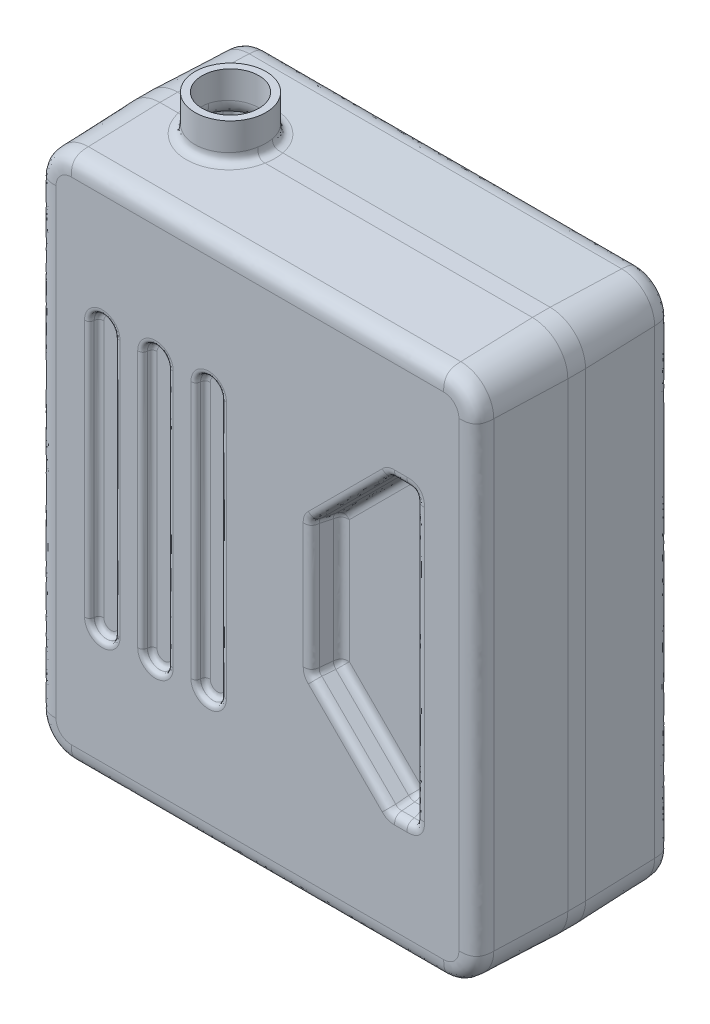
SolidWorks part; units mm, degrees
ref_plane "Front Plane" through (0, 0, 0) normal (0, 0, 1) x (1, 0, 0)
ref_plane "Top Plane" through (0, 0, 0) normal (0, 1, 0) x (1, 0, 0)
ref_plane "Right Plane" through (0, 0, 0) normal (1, 0, 0) x (0, 0, -1)
sketch "Sketch1" plane through (0, 0, 0) normal (0, 0, 1) x (1, 0, 0)
  line L1 (0, 0) -> (250, 0)
  line L2 (0, 0) -> (0, 300)
  line L3 (0, 300) -> (250, 300)
  line L4 (250, 0) -> (250, 300)
  dimension "D1" = 250
  dimension "D2" = 300
sketch "Sketch2" plane through (0, 0, 0) normal (0, 0, 1) x (1, 0, 0)
  line L0 (0, 280) -> (0, 20)
  line L1 (20, 0) -> (230, 0)
  line L2 (250, 20) -> (250, 280)
  line L3 (230, 300) -> (70, 300)
  line L4 (35, 300) -> (35, 320)
  line L5 (35, 320) -> (70, 320)
  line L6 (70, 320) -> (70, 300)
  line L8 (215, 67.5) -> (200, 67.5)
  line L9 (200, 67.5) -> (155, 112.5)
  line L10 (155, 112.5) -> (155, 187.5)
  line L11 (155, 187.5) -> (200, 232.5)
  line L12 (200, 232.5) -> (215, 232.5)
  line L13 (215, 150) -> (155, 150) construction
  line L14 (215, 232.5) -> (215, 67.5)
  line L15 (35, 300) -> (20, 300)
  arc A0 (0, 20) -> (20, 0) centre (20, 20) ccw
  arc A1 (230, 0) -> (250, 20) centre (230, 20) ccw
  arc A2 (250, 280) -> (230, 300) centre (230, 280) ccw
  arc A3 (0, 280) -> (20, 300) centre (20, 280) cw
  point P10 (0, 0)
  point P13 (250, 0)
  point P16 (250, 300)
  point P19 (0, 300)
  point P34 (250, 150)
  dimension "D1" = 20
  dimension "D2" = 35
  dimension "D3" = 165
  dimension "D4" = 15
  dimension "D5" = 60
  dimension "D6" = 35
  dimension "D7" = 20
  dimension "D8" = 15
sketch "Sketch3" plane through (0, 0, 0) normal (0, 0, 1) x (1, 0, 0)
  line L0 (230, 300) -> (70, 300) construction
  line L4 (35, 300) -> (20, 300) construction
  line L5 (0, 280) -> (0, 20) construction
  line L6 (20, 0) -> (230, 0) construction
  line L7 (250, 20) -> (250, 280) construction
  line L8 (230, 300) -> (70, 300)
  line L12 (70, 300) -> (20, 300)
  line L13 (0, 280) -> (0, 20)
  line L14 (20, 0) -> (230, 0)
  line L15 (250, 20) -> (250, 280)
  arc A0 (20, 300) -> (0, 280) centre (20, 280) ccw construction
  arc A1 (0, 20) -> (20, 0) centre (20, 20) ccw construction
  arc A2 (230, 0) -> (250, 20) centre (230, 20) ccw construction
  arc A3 (250, 280) -> (230, 300) centre (230, 280) ccw construction
  arc A4 (20, 300) -> (0, 280) centre (20, 280) ccw
  arc A5 (0, 20) -> (20, 0) centre (20, 20) ccw
  arc A6 (230, 0) -> (250, 20) centre (230, 20) ccw
  arc A7 (250, 280) -> (230, 300) centre (230, 280) ccw
extrude "Boss-Extrude1" add sketch "Sketch3" along normal blind 50 draft 2
sketch "Sketch4" plane through (0, 0, 50) normal (0, 0, 1) x (1, 0, 0)
  line L0 (215, 232.5) -> (215, 67.5) construction
  line L1 (215, 67.5) -> (200, 67.5) construction
  line L2 (200, 67.5) -> (155, 112.5) construction
  line L3 (155, 112.5) -> (155, 187.5) construction
  line L4 (155, 187.5) -> (200, 232.5) construction
  line L5 (200, 232.5) -> (215, 232.5) construction
  line L6 (215, 232.5) -> (215, 67.5)
  line L7 (215, 67.5) -> (200, 67.5)
  line L8 (200, 67.5) -> (155, 112.5)
  line L9 (155, 112.5) -> (155, 187.5)
  line L10 (155, 187.5) -> (200, 232.5)
  line L11 (200, 232.5) -> (215, 232.5)
extrude "Cut-Extrude1" cut sketch "Sketch4" against normal blind 15 draft 10
sketch "Sketch5" plane through (0, 0, 50) normal (0, 0, 1) x (1, 0, 0)
  line L0 (37.5, 222.5) -> (37.5, 77.5) construction
  line L1 (45, 222.5) -> (45, 77.5)
  line L2 (30, 222.5) -> (30, 77.5)
  line L4 (37.5, 150) -> (142.9758, 150) construction
  line L5 (67.5, 222.5) -> (67.5, 77.5) construction
  line L6 (75, 222.5) -> (75, 77.5)
  line L7 (60, 222.5) -> (60, 77.5)
  line L8 (97.5, 222.5) -> (97.5, 77.5) construction
  line L9 (105, 222.5) -> (105, 77.5)
  line L10 (90, 222.5) -> (90, 77.5)
  arc A0 (45, 222.5) -> (30, 222.5) centre (37.5, 222.5) ccw
  arc A1 (30, 77.5) -> (45, 77.5) centre (37.5, 77.5) ccw
  arc A2 (75, 222.5) -> (60, 222.5) centre (67.5, 222.5) ccw
  arc A3 (60, 77.5) -> (75, 77.5) centre (67.5, 77.5) ccw
  arc A4 (105, 222.5) -> (90, 222.5) centre (97.5, 222.5) ccw
  arc A5 (90, 77.5) -> (105, 77.5) centre (97.5, 77.5) ccw
  point P2 (37.5, 150)
  point P15 (67.5, 150)
  point P22 (97.5, 150)
  dimension "D1" = 15
  dimension "D2" = 145
  dimension "D3" = 30
  dimension "D4" = 3
extrude "Cut-Extrude2" cut sketch "Sketch5" against normal blind 5 draft 10
fillet "Fillet1" radius 10 8 edges at (242.9075, 292.9075, 50) (248.254, 150, 50) (242.9075, 7.0925, 50) (125, 1.746, 50) (7.0925, 7.0925, 50) (1.746, 150, 50) (7.0925, 292.9075, 50) (125, 298.254, 50)
sketch "Sketch6" plane through (0, 0, 0) normal (0, 0, -1) x (-1, 0, 0)
  line L4 (-250, 280) -> (-250, 20)
  line L5 (-230, 0) -> (-20, 0)
  line L6 (0, 20) -> (0, 280)
  line L7 (-20, 300) -> (-230, 300)
  line L8 (-250, 280) -> (-250, 20)
  line L9 (-230, 0) -> (-20, 0)
  line L10 (0, 20) -> (0, 280)
  line L11 (-20, 300) -> (-230, 300)
  arc A4 (-230, 300) -> (-250, 280) centre (-230, 280) ccw
  arc A5 (-250, 20) -> (-230, 0) centre (-230, 20) ccw
  arc A6 (-20, 0) -> (0, 20) centre (-20, 20) ccw
  arc A7 (0, 280) -> (-20, 300) centre (-20, 280) ccw
  arc A8 (-230, 300) -> (-250, 280) centre (-230, 280) ccw
  arc A9 (-250, 20) -> (-230, 0) centre (-230, 20) ccw
  arc A10 (-20, 0) -> (0, 20) centre (-20, 20) ccw
  arc A11 (0, 280) -> (-20, 300) centre (-20, 280) ccw
  dimension "D1" = 0
extrude "Boss-Extrude2" add sketch "Sketch6" along normal blind 5
fillet "Fillet2" radius 5 18 edges at (155, 150, 50) (177.5, 90, 50) (177.5, 210, 50) (207.5, 67.5, 50) (207.5, 232.5, 50) (212.3551, 150, 35) (206.7253, 70.1449, 35) (179.3702, 91.8702, 35) (157.6449, 150, 35) (179.3702, 208.1298, 35) (206.7253, 229.8551, 35) (215, 150, 50) (200.5478, 231.1775, 42.5) (156.3225, 113.0478, 42.5) (200.5478, 68.8225, 42.5) (213.6775, 68.8225, 42.5) (213.6775, 231.1775, 42.5) (156.3225, 186.9522, 42.5)
fillet "Fillet3" radius 3 24 edges at (37.5, 70, 50) (30, 150, 50) (37.5, 230, 50) (67.5, 70, 50) (60, 150, 50) (67.5, 230, 50) (97.5, 70, 50) (90, 150, 50) (97.5, 230, 50) (45, 150, 50) (75, 150, 50) (97.5, 229.1184, 45) (90.8816, 150, 45) (97.5, 70.8816, 45) (67.5, 229.1184, 45) (60.8816, 150, 45) (67.5, 70.8816, 45) (37.5, 229.1184, 45) (30.8816, 150, 45) (37.5, 70.8816, 45) (44.1184, 150, 45) (74.1184, 150, 45) (105, 150, 50) (104.1184, 150, 45)
mirror "Mirror1" about plane through (230, 280, -5) normal (0, 0, -1)
sketch "Sketch7" plane through (0, 300, 0) normal (0, 1, 0) x (1, 0, 0)
  circle A0 centre (54.8055, 5) radius 20
  dimension "D1" = 40
  dimension "D2" = 5
  dimension "D3" = 54.8055
extrude "Boss-Extrude3" add sketch "Sketch7" along normal mid plane 40
fillet "Fillet4" radius 5 4 edges at (54.8055, 299.4762, -25) (34.8055, 300, -5) (74.8055, 300, -5) (54.8055, 299.4762, 15)
shell "Shell1" thickness 4
